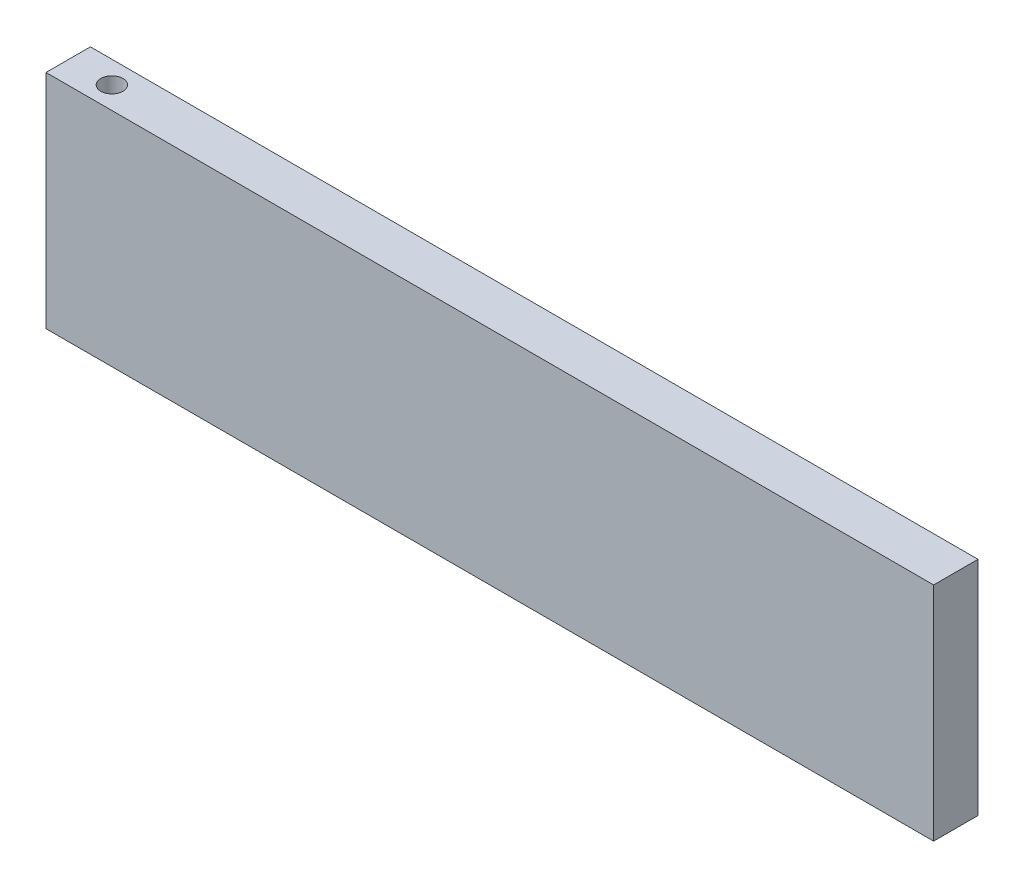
SolidWorks part; units mm, degrees
ref_plane "Front Plane" through (0, 0, 0) normal (0, 0, 1) x (1, 0, 0)
ref_plane "Top Plane" through (0, 0, 0) normal (0, 1, 0) x (1, 0, 0)
ref_plane "Right Plane" through (0, 0, 0) normal (1, 0, 0) x (0, 0, -1)
sketch "Sketch1" plane through (0, 0, 0) normal (0, 0, 1) x (1, 0, 0)
  line L0 (-284.8179, 0) -> (294.0055, 0) construction
  line L1 (0, 142.8266) -> (0, -119.4397) construction
  line L3 (-254, -63.5) -> (254, -63.5)
  line L4 (-254, -63.5) -> (-254, 63.5)
  line L5 (-254, 63.5) -> (254, 63.5)
  line L6 (254, -63.5) -> (254, 63.5)
extrude "Extrude1" add sketch "Sketch1" along normal blind 12.7
sketch "Sketch2" plane through (0, -63.5, 0) normal (0, -1, 0) x (1, 0, 0)
  line L0 (0, 206.0779) -> (0, -185.7131) construction
  line L1 (328.9859, 6.35) -> (-261.8102, 6.35) construction
  line L2 (-254, 12.7) -> (254, 12.7) construction
  circle A0 centre (12.5, 6.35) radius 3.175
  dimension "D2" = 6.35
  dimension "D3" = 25
  dimension "D1" = 6.35
extrude "Cut-Extrude2" cut sketch "Sketch2" against normal through all
mirror "Mirror1" about plane through (0, 0, 0) normal (1, 0, 0) of "Cut-Extrude2"
sketch "Sketch3" plane through (0, 0, 12.7) normal (0, 0, 1) x (1, 0, 0)
  line L0 (0, -63.5) -> (0, 0)
  line L1 (0, 0) -> (254, 0)
  line L2 (254, -63.5) -> (254, 63.5) construction
  line L3 (-254, -63.5) -> (254, -63.5) construction
extrude "double symmetry" cut sketch "Sketch3" against normal through all and the other way through all
equation "\"D4@Sketch1\" = \"D3@Sketch1\"*.5"
